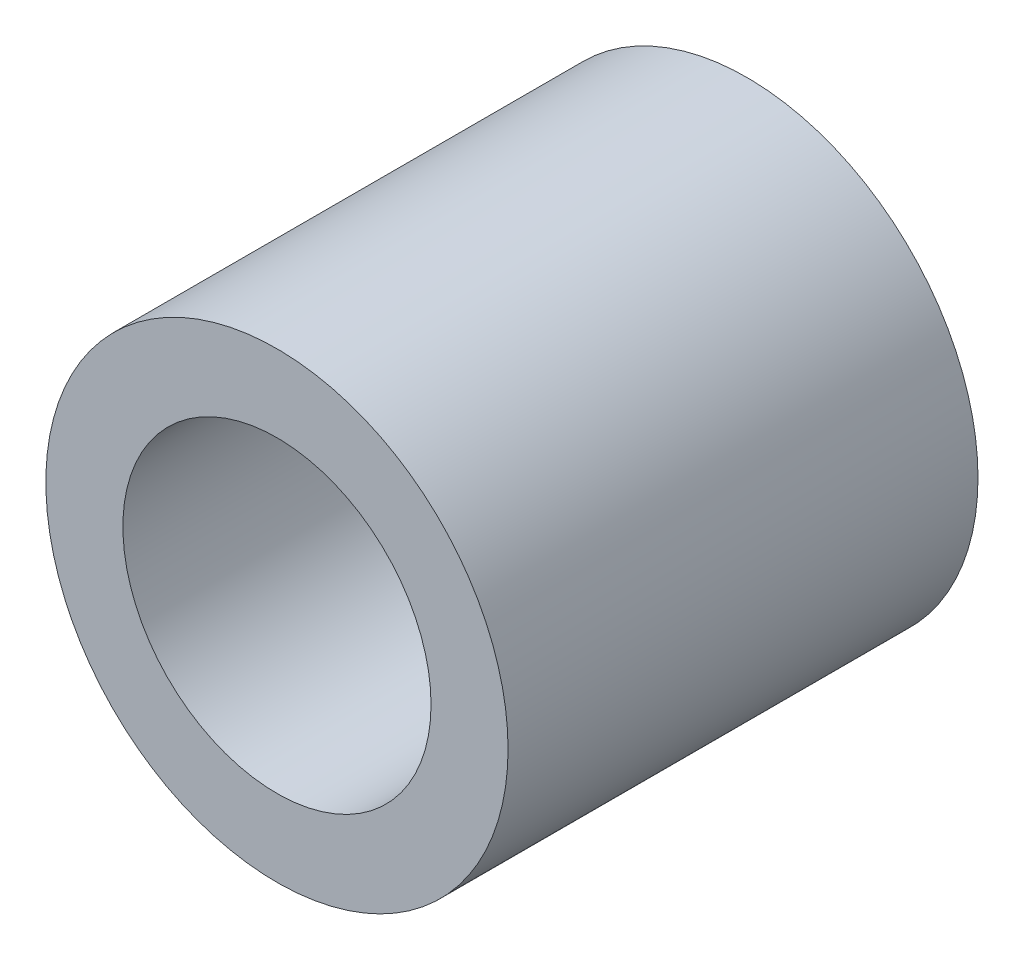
SolidWorks part; units mm, degrees
ref_plane "Plan de face" through (0, 0, 0) normal (0, 0, 1) x (1, 0, 0)
ref_plane "Plan de dessus" through (0, 0, 0) normal (0, 1, 0) x (1, 0, 0)
ref_plane "Plan de droite" through (0, 0, 0) normal (1, 0, 0) x (0, 0, -1)
sketch "Esquisse1" plane through (0, 0, 0) normal (0, 0, 1) x (1, 0, 0)
  circle A0 centre (0, 0) radius 3
  circle A1 centre (0, 0) radius 2
extrude "Extrusion1" add sketch "Esquisse1" along normal blind 6.1
